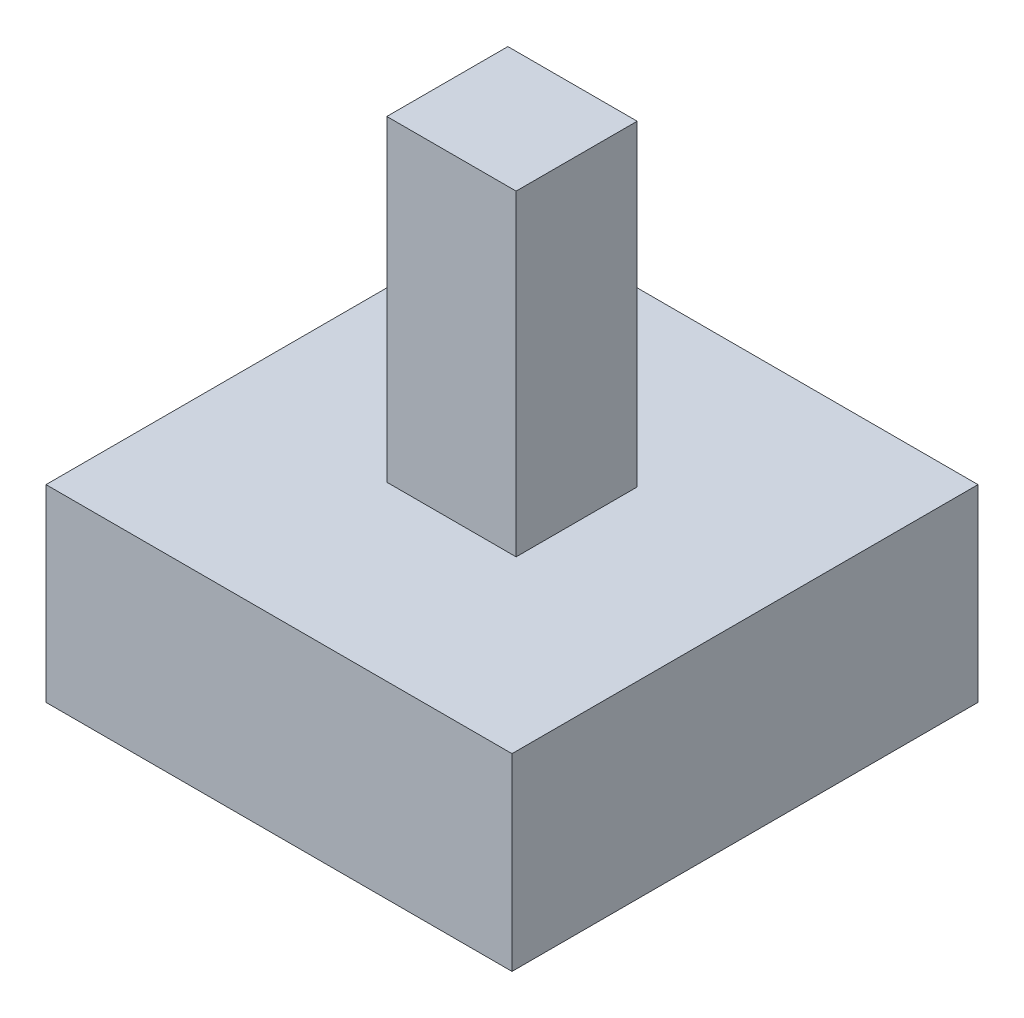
SolidWorks part; units mm, degrees
ref_plane "Front Plane" through (0, 0, 0) normal (0, 0, 1) x (1, 0, 0)
ref_plane "Top Plane" through (0, 0, 0) normal (0, 1, 0) x (1, 0, 0)
ref_plane "Right Plane" through (0, 0, 0) normal (1, 0, 0) x (0, 0, -1)
sketch "Sketch1" plane through (0, 0, 0) normal (0, 1, 0) x (1, 0, 0)
  line L0 (48.7636, -48.7636) -> (-48.7636, 48.7636) construction
  line L1 (-48.7636, 48.7636) -> (48.7636, 48.7636)
  line L2 (-48.7636, 48.7636) -> (-48.7636, -48.7636)
  line L3 (-48.7636, -48.7636) -> (48.7636, -48.7636)
  line L4 (48.7636, 48.7636) -> (48.7636, -48.7636)
extrude "Extrude1" add sketch "Sketch1" along normal blind 39.4736
sketch "Sketch2" plane through (0, 39.4736, 0) normal (0, 1, 0) x (-1, 0, 0)
  line L0 (-13.5286, 12.6672) -> (13.5286, -12.6672) construction
  line L1 (-13.5286, 12.6672) -> (13.5286, 12.6672)
  line L2 (-13.5286, 12.6672) -> (-13.5286, -12.6672)
  line L3 (-13.5286, -12.6672) -> (13.5286, -12.6672)
  line L4 (13.5286, 12.6672) -> (13.5286, -12.6672)
extrude "Extrude2" add sketch "Sketch2" along normal blind 66.2965
